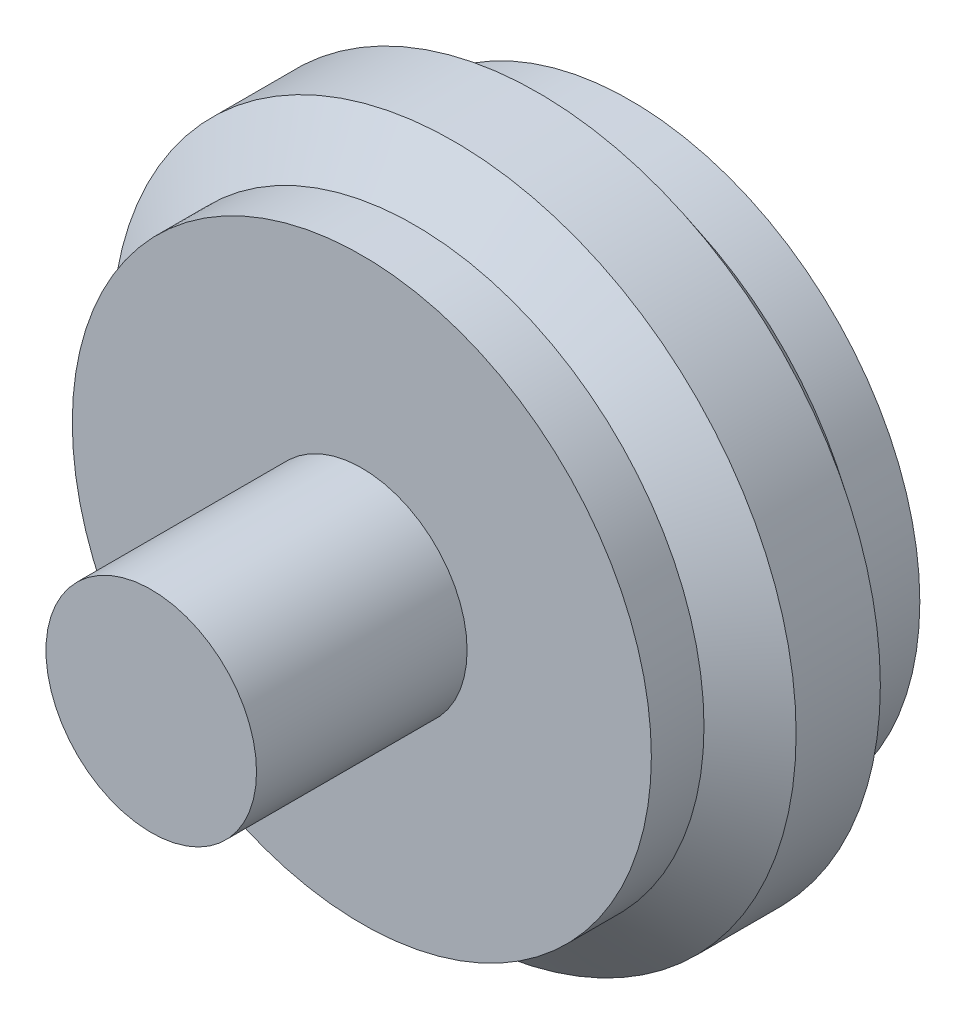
SolidWorks part; units mm, degrees
ref_plane "前视基准面" through (0, 0, 0) normal (0, 0, 1) x (1, 0, 0)
ref_plane "上视基准面" through (0, 0, 0) normal (0, 1, 0) x (1, 0, 0)
ref_plane "右视基准面" through (0, 0, 0) normal (1, 0, 0) x (0, 0, -1)
other "Configuration Table"
sketch "草图1" plane through (0, 0, 0) normal (0, 1, 0) x (1, 0, 0)
  line L0 (0, 0) -> (11, 0)
  line L1 (0, 0) -> (0, 6.2)
  line L2 (0, 6.2) -> (11, 6.2)
  line L6 (11, 6.2) -> (13, 4.7)
  line L9 (11, 0) -> (13, 1.5)
  line L10 (13, 4.7) -> (13, 1.5)
revolve "旋转1" add sketch "草图1" angle 360 about L1
sketch "草图2" plane through (0, 0, 0) normal (0, 0, 1) x (1, 0, 0)
  circle A0 centre (0, 0) radius 4
extrude "凸台-拉伸1" add sketch "草图2" along normal blind 10
sketch "草图3" plane through (0, 0, 0) normal (0, 0, 1) x (1, 0, 0)
  circle A0 centre (0, 0) radius 11
extrude "凸台-拉伸2" add sketch "草图3" along normal blind 2
sketch "草图4" plane through (0, 0, -6.2) normal (0, 0, -1) x (-1, 0, 0)
  circle A0 centre (0, 0) radius 11
extrude "凸台-拉伸3" add sketch "草图4" along normal blind 2
